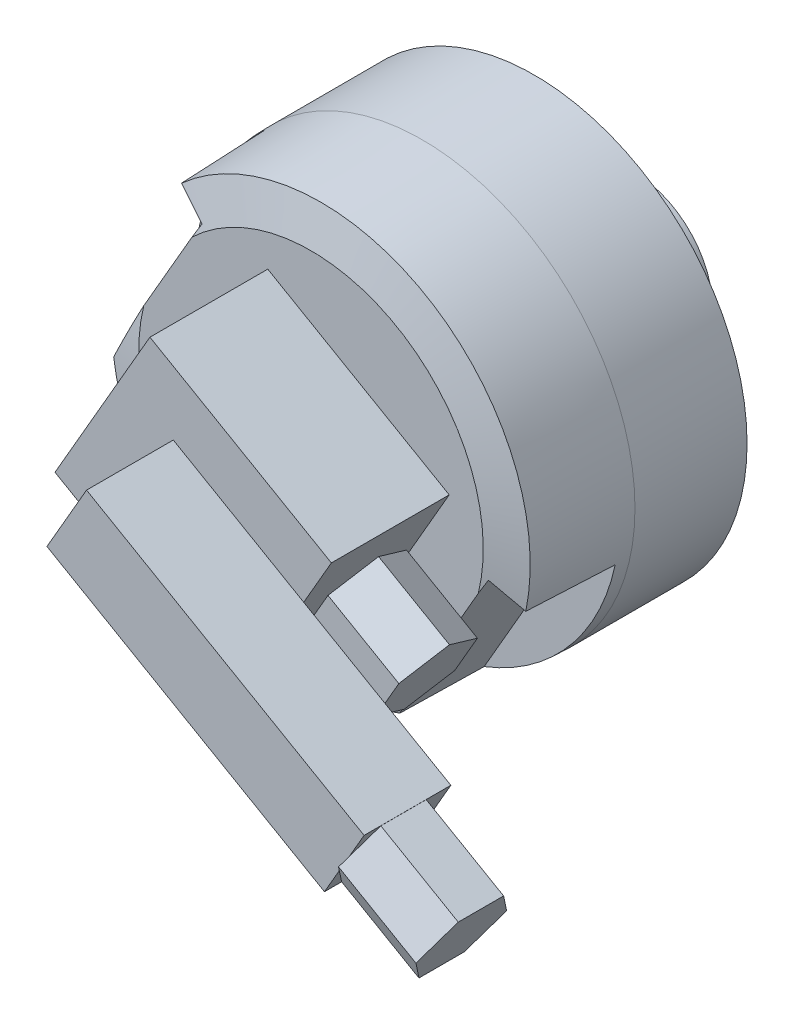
SolidWorks part; units mm, degrees
ref_plane "Ebene vorne" through (0, 0, 0) normal (0, 0, 1) x (1, 0, 0)
ref_plane "Ebene oben" through (0, 0, 0) normal (0, 1, 0) x (1, 0, 0)
ref_plane "Ebene rechts" through (0, 0, 0) normal (1, 0, 0) x (0, 0, -1)
sketch "Skizze2" plane through (0, 0, 0) normal (0, 1, 0) x (1, 0, 0)
  line L0 (0, -24.899) -> (0, 51.5236) construction
  line L1 (-24, 0) -> (-65, 0)
  line L2 (-65, 0) -> (-65, -34.24)
  line L3 (-24, 0) -> (-24, 30.5)
  line L4 (-65, -34.24) -> (-63.9199, -65.1695)
  line L5 (-63.9199, -65.1695) -> (-52.61, -68.2)
  line L6 (-52.61, -68.2) -> (0, -68.2)
  line L7 (-24, 30.5) -> (0, 30.5)
  line L8 (0, -68.2) -> (0, 30.5)
  dimension "D1" = 30.5
  dimension "D2" = 48
  dimension "D3" = 130
  dimension "D4" = 68.2
  dimension "D5" = 34.24
  dimension "D6" = 15
  dimension "D7" = 2
  dimension "D8" = 52.61
revolve "Rotation1" add sketch "Skizze2" angle 360 about L0
sketch "Skizze10" plane through (0, 0, 68.2) normal (0, 0, 1) x (1, 0, 0)
  line L0 (-33.7343, 42.5705) -> (-83.7343, -44.032)
  line L1 (-33.7343, 42.5705) -> (-51.0548, 52.5705)
  line L2 (-83.7343, -44.032) -> (-101.0548, -34.032)
  line L3 (-51.0548, 52.5705) -> (-101.0548, -34.032)
  line L4 (53.7343, -7.9295) -> (3.7343, -94.532)
  line L5 (53.7343, -7.9295) -> (71.0548, -17.9295)
  line L6 (3.7343, -94.532) -> (21.0548, -104.532)
  line L7 (71.0548, -17.9295) -> (21.0548, -104.532)
  line L8 (-33.7343, 42.5705) -> (53.7343, -7.9295) construction
  line L9 (10, 17.3205) -> (0, 0) construction
  line L10 (0, 0) -> (65, 0) construction
  circle A0 centre (0, 0) radius 65 construction
  dimension "D1" = 60
  dimension "D2" = 101
  dimension "D3" = 20
  dimension "D4" = 100
  dimension "D5" = 20
extrude "Schnitt-Linear austragen1" cut sketch "Skizze10" against normal blind 29.5
sketch "Skizze9" plane through (0, 0, 68.2) normal (0, 0, 1) x (1, 0, 0)
  line L0 (-42.2128, -9.1147) -> (13.2128, -41.1147)
  line L1 (-42.2128, -9.1147) -> (-13.2128, 41.1147)
  line L2 (13.2128, -41.1147) -> (42.2128, 9.1147)
  line L3 (-13.2128, 41.1147) -> (42.2128, 9.1147)
  line L4 (-27.7128, 16) -> (0, 0) construction
  line L5 (0, 0) -> (14.5, 25.1147) construction
  line L6 (0, 0) -> (65, 0) construction
  circle A0 centre (0, 0) radius 65 construction
  point P11 (-27.7128, 16)
  dimension "D1" = 60
  dimension "D2" = 58
  dimension "D3" = 64
extrude "Aufsatz-Linear austragen6" add sketch "Skizze9" along normal blind 36
sketch "Skizze11" plane through (0, 0, 104.2) normal (0, 0, 1) x (1, 0, 0)
  line L0 (-6.0744, 17.4789) -> (-18.1744, -3.4789)
  line L1 (-6.0744, 17.4789) -> (78.7095, -31.4711)
  line L2 (-18.1744, -3.4789) -> (66.6095, -52.4289)
  line L3 (78.7095, -31.4711) -> (66.6095, -52.4289)
  line L4 (-12.1244, 7) -> (0, 0) construction
  line L5 (0, 0) -> (72.6595, -41.95) construction
  line L6 (0, 0) -> (65, 0) construction
  circle A0 centre (0, 0) radius 65 construction
  dimension "D1" = 14
  dimension "D2" = 24.2
  dimension "D3" = 97.9
  dimension "D4" = 30
extrude "Aufsatz-Linear austragen7" add sketch "Skizze11" along normal blind 26.5
sketch "Skizze12" plane through (72.6595, -41.95, 0) normal (0.866, -0.5, 0) x (0, 0, -1)
  line L0 (-118.6, 0) -> (-130.7, 0) construction
  line L1 (-132.4564, 0) -> (-125.5282, -12)
  line L2 (-125.5282, -12) -> (-111.6718, -12)
  line L3 (-111.6718, -12) -> (-104.7436, 0)
  line L4 (-104.7436, 0) -> (-111.6718, 12)
  line L5 (-111.6718, 12) -> (-125.5282, 12)
  line L6 (-125.5282, 12) -> (-132.4564, 0)
  line L7 (-130.7, -12.1) -> (-130.7, 12.1) construction
  circle A0 centre (-118.6, 0) radius 12 construction
  dimension "D2" = 24
  dimension "D1" = 12.1
extrude "Aufsatz-Linear austragen8" add sketch "Skizze12" along normal blind 27.3
sketch "Skizze13" plane through (27.7128, -16, 0) normal (0.866, -0.5, 0) x (0, 0, -1)
  line L0 (-68.2, 52.61) -> (-68.2, -52.61) construction
  line L1 (-82.2, 13.8564) -> (-94.2, 6.9282)
  line L2 (-94.2, 6.9282) -> (-94.2, -6.9282)
  line L3 (-94.2, -6.9282) -> (-82.2, -13.8564)
  line L4 (-82.2, -13.8564) -> (-70.2, -6.9282)
  line L5 (-70.2, -6.9282) -> (-70.2, 6.9282)
  line L6 (-70.2, 6.9282) -> (-82.2, 13.8564)
  line L7 (-82.2, 0) -> (0, 0) construction
  circle A0 centre (-82.2, 0) radius 12 construction
  dimension "D1" = 24
  dimension "D2" = 14
extrude "Aufsatz-Linear austragen9" add sketch "Skizze13" along normal blind 25
